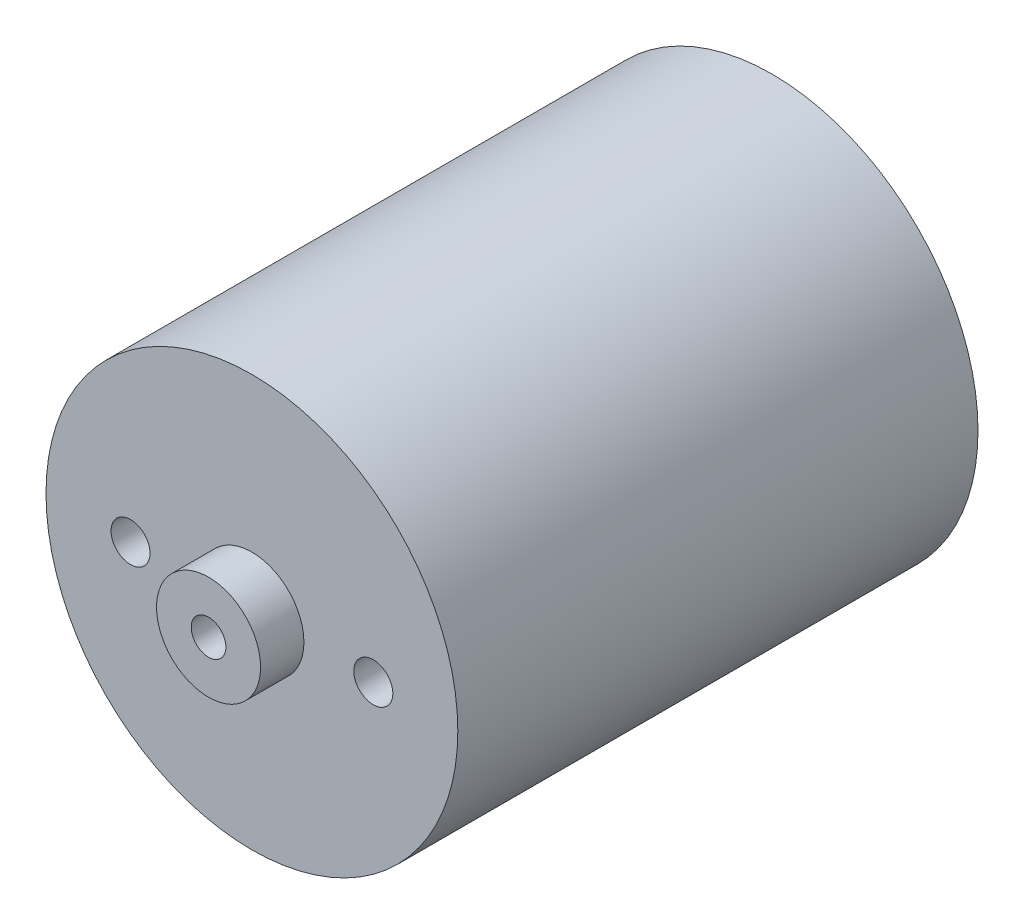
SolidWorks part; units mm, degrees
ref_plane "Front Plane" through (0, 0, 0) normal (0, 0, 1) x (1, 0, 0)
ref_plane "Top Plane" through (0, 0, 0) normal (0, 1, 0) x (1, 0, 0)
ref_plane "Right Plane" through (0, 0, 0) normal (1, 0, 0) x (0, 0, -1)
sketch "Sketch1" plane through (0, 0, 0) normal (0, 0, 1) x (1, 0, 0)
  circle A0 centre (0, 0) radius 12.065
  dimension "D1" = 24.13
extrude "Boss-Extrude2" add sketch "Sketch1" against normal blind 30.48
sketch "Sketch3" plane through (0, 0, 0) normal (0, 0, 1) x (1, 0, 0)
  circle A0 centre (0, 0) radius 3.048
  dimension "D1" = 6.096
extrude "Boss-Extrude3" add sketch "Sketch3" along normal blind 2.54
sketch "Sketch4" plane through (0, 0, 0) normal (0, 0, 1) x (1, 0, 0)
  line L0 (-12.065, 0) -> (11.2084, 0) construction
  line L1 (0, 11.642) -> (0, -10.9997) construction
  circle A0 centre (-7.112, 0) radius 1.143
  circle A1 centre (0, 0) radius 12.065 construction
  circle A2 centre (7.112, 0) radius 1.143
  point P7 (-12.065, 0)
  point P10 (-12.065, 0)
  dimension "D1" = 2.286
  dimension "D2" = 4.953
extrude "Cut-Extrude1" cut sketch "Sketch4" against normal blind 2.54
sketch "Sketch5" plane through (0, 0, 2.54) normal (0, 0, 1) x (1, 0, 0)
  circle A0 centre (0, 0) radius 1.016
  dimension "D1" = 2.032
extrude "Cut-Extrude2" cut sketch "Sketch5" against normal through all
